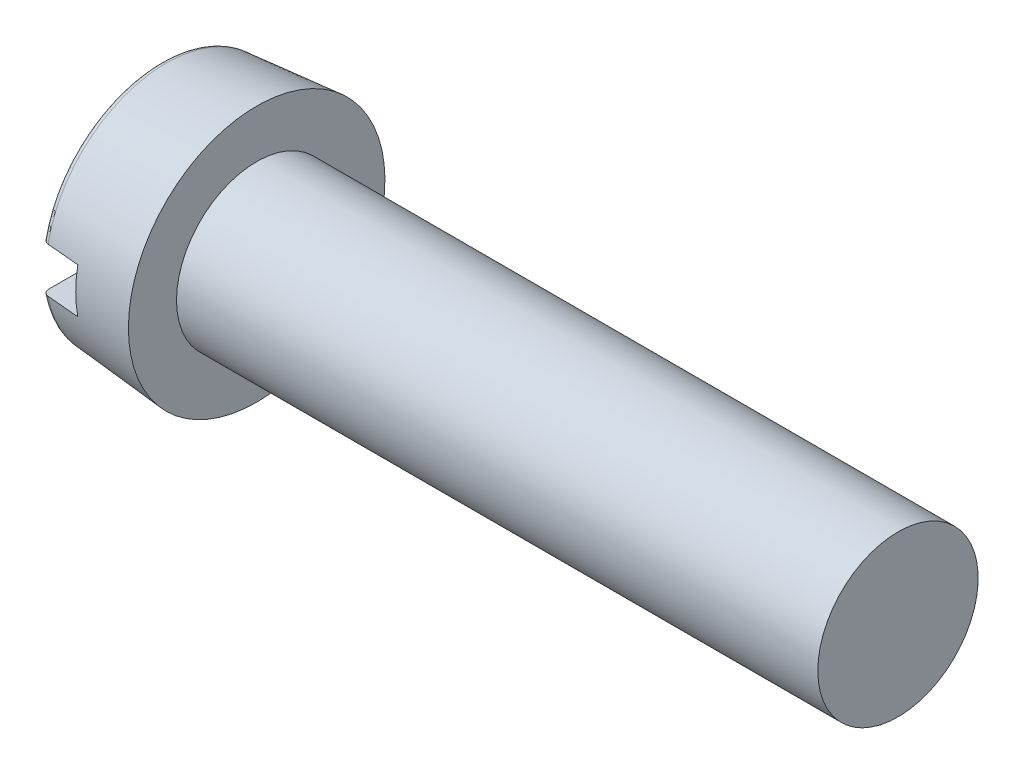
SolidWorks part; units mm, degrees
ref_plane "Front Plane" through (0, 0, 0) normal (0, 0, 1) x (1, 0, 0)
ref_plane "Top Plane" through (0, 0, 0) normal (0, 1, 0) x (1, 0, 0)
ref_plane "Right Plane" through (0, 0, 0) normal (1, 0, 0) x (0, 0, -1)
sketch "BodySke" plane through (0, 0, 0) normal (0, 0, 1) x (1, 0, 0)
  line L0 (0, 0) -> (111.3824, 0) construction
  line L1 (0, 0) -> (0, 7.4751)
  line L2 (0, 7.4751) -> (6, 8)
  line L3 (6, 8) -> (6, 5)
  line L4 (6, 5) -> (46, 5)
  line L5 (46, 5) -> (46, 0)
  line L6 (7.5, 8.824) -> (7.5, -5.8939) construction
  line L7 (0, 0) -> (46, 0)
  line L8 (9, 8.824) -> (9, -4.958) construction
  point P10 (46, 4.172)
  dimension "Diameter" = 10
  dimension "Head_dia" = 16
  dimension "Head_height" = 6
  dimension "Head_side_angle" = 5
  dimension "Length" = 40
  dimension "Advance" = 1.5
  dimension "Thread_minor" = 8.344
  dimension "Thread_runout" = 3
revolve "BaseBody" add sketch "BodySke" angle 360 about L0
fillet "Fillet1" radius 0.4 1 edges at (0, 0, 7.4751)
sketch "SlotSke" plane through (0, 0, 0) normal (-1, 0, 0) x (0, 0, 1)
  line L1 (-8, 1.405) -> (8, 1.405)
  line L2 (-8, 1.405) -> (-8, -1.405)
  line L3 (-8, -1.405) -> (8, -1.405)
  line L4 (8, 1.405) -> (8, -1.405)
  dimension "D1" = 16
  dimension "D2" = 8
  dimension "D3" = 1.405
  dimension "Slot_width" = 2.81
extrude "Slot" cut sketch "SlotSke" against normal blind 2.4
sketch "ThdSchSke" plane through (0, 0, 0) normal (0, 0, 1) x (1, 0, 0)
  line L0 (0, 0) -> (55.1256, 0) construction
  line L1 (0, 0) -> (111.3824, 0) construction
  line L2 (45.522, 5) -> (45.522, 5.9561)
  line L3 (45.522, 5.9561) -> (46.478, 5.9561)
  line L4 (46.478, 5.9561) -> (46.478, 5)
  line L5 (46.478, 5) -> (46, 4.172)
  line L6 (46, 4.172) -> (45.522, 5)
  line L7 (6, 5) -> (46, 5) construction
  line L13 (46, 5) -> (46, 0) construction
revolve "ThreadSchematic" [suppressed] cut sketch "ThdSchSke" angle 360 about L0
pattern_linear "ThdSchPat" [suppressed] count 25 along (1, 0, 0)
equation "\"Thread_minor@ThreadCosmetic\" = \"Thread_minor@BodySke\""
equation "\"D1@SlotSke\" = \"Head_dia@BodySke\""
equation "\"D2@SlotSke\" = \"D1@SlotSke\" / 2"
equation "\"D3@SlotSke\" = \"Slot_width@SlotSke\" / 2"
equation "\"Advance@ThdSchPat\" = \"Advance@BodySke\""
equation "\"D1@ThdSchPat\" =  int(  ( \"Length@BodySke\" - \"Thread_runout@BodySke\" )  / \"Advance@ThdSchPat\" )  + 1"
